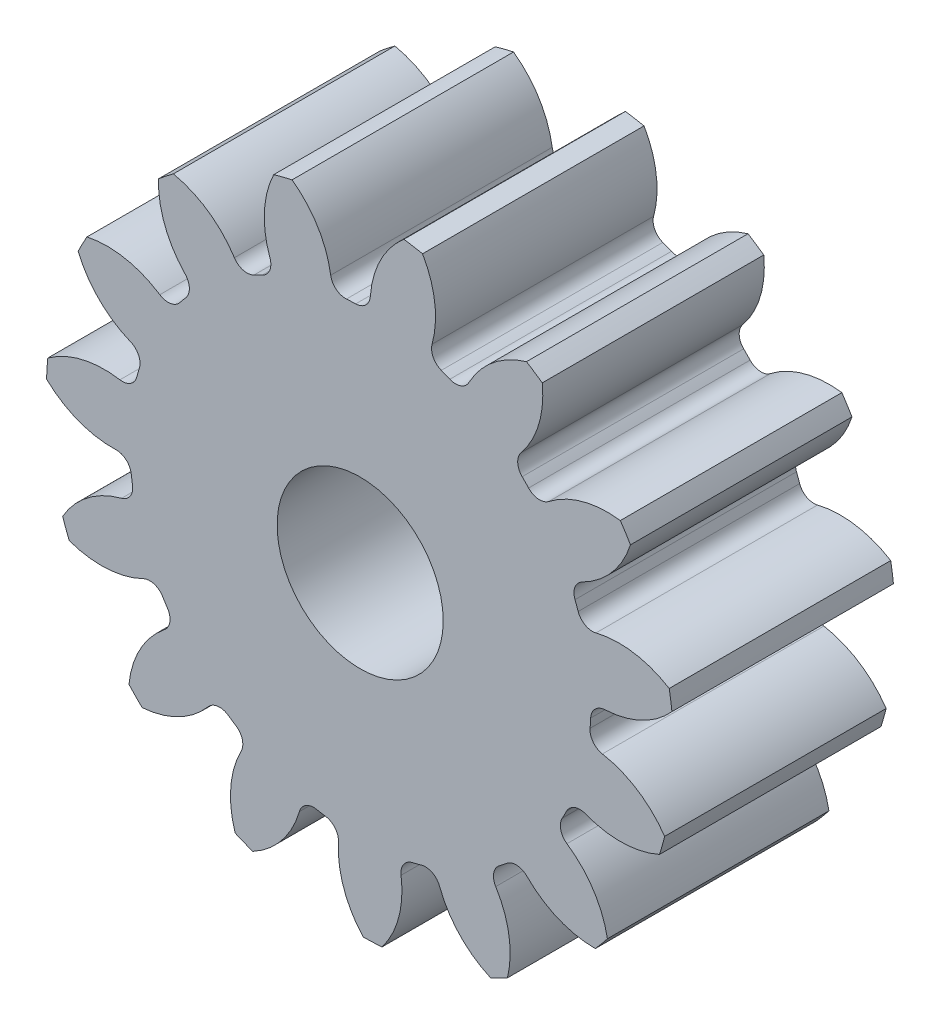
SolidWorks part; units mm, degrees
ref_plane "Front" through (0, 0, 0) normal (0, 0, 1) x (1, 0, 0)
ref_plane "Top" through (0, 0, 0) normal (0, 1, 0) x (1, 0, 0)
ref_plane "Right" through (0, 0, 0) normal (1, 0, 0) x (0, 0, -1)
sketch "Sketch3" plane through (0, 0, 0) normal (0, 0, 1) x (1, 0, 0)
  circle A0 centre (0, 0) radius 143.9333
  dimension "od" = 287.8667
extrude "gearBody" add sketch "Sketch3" along normal blind 101.6
sketch "Sketch2" plane through (0, 0, 0) normal (0, 0, 1) x (1, 0, 0)
  line L0 (0, 0) -> (110.2567, 45.6698) construction
  line L1 (140.4413, -36.0284) -> (0, 0) construction
  line L2 (0, 0) -> (36.3143, 0) construction
  line L3 (126.9009, 5.017) -> (125.1716, -21.4725) construction
  line L5 (126.0362, -8.2278) -> (0, 0) construction
  line L7 (0, 0) -> (119.341, 0) construction
  arc A0 (119.3108, 2.6849) -> (117.9491, -18.1734) centre (0, 0) ccw construction
  arc A1 (142.9979, 16.3834) -> (139.6543, -34.8352) centre (0, 0) ccw construction
  arc A2 (126.9009, 5.017) -> (125.1716, -21.4725) centre (0, 0) ccw construction
  arc A3 (105.4498, -9.0016) -> (105.7251, -4.7841) centre (0, 0) ccw
  arc A4 (140.4413, -36.0284) -> (111.1053, -16.3723) centre (103.3835, -59.6164) ccw
  arc A5 (140.4413, -36.0284) -> (143.9333, 17.4641) centre (0, 0) ccw
  arc A6 (143.9333, 17.4641) -> (112.2908, 1.7888) centre (110.2567, 45.6698) cw
  arc A7 (105.7251, -4.7841) -> (112.2908, 1.7888) centre (112.61, -5.0956) cw
  arc A8 (111.1053, -16.3723) -> (105.4498, -9.0016) centre (112.3167, -9.5878) cw
  point P6 (143.9333, 17.4641)
  point P22 (140.4413, -36.0284)
  dimension "baseDia" = 238.6819
  dimension "od" = 287.8667
  dimension "pd" = 254
  dimension "rd" = 211.6667
  dimension "rFillet" = 6.8919
  dimension "pointX" = 143.9333
  dimension "pointY" = 17.4641
  dimension "CTT" = 26.4896
  dimension "flankCenterAngle" = 22.5
extrude "toothCut" cut sketch "Sketch2" along normal through all
pattern_circular "CirPattern1" count 15 over 360 about axis through (0, 0, 0) along (0, 0, 1) of "toothCut"
sketch "hub1Dia" plane through (0, 0, 0) normal (0, 0, -1) x (-1, 0, 0)
  circle A0 centre (0, 0) radius 12.7
  dimension "hub1Dia" = 25.4
sketch "hub2Dia" plane through (0, 0, 101.6) normal (0, 0, 1) x (1, 0, 0)
  circle A0 centre (0, 0) radius 12.7
  dimension "hub2dia" = 25.4
sketch "boreDia" plane through (0, 0, 0) normal (0, 0, 1) x (1, 0, 0)
  circle A0 centre (0, 0) radius 38.1
  dimension "boreDia" = 76.2
extrude "bore" cut sketch "boreDia" against normal mid plane 25400
